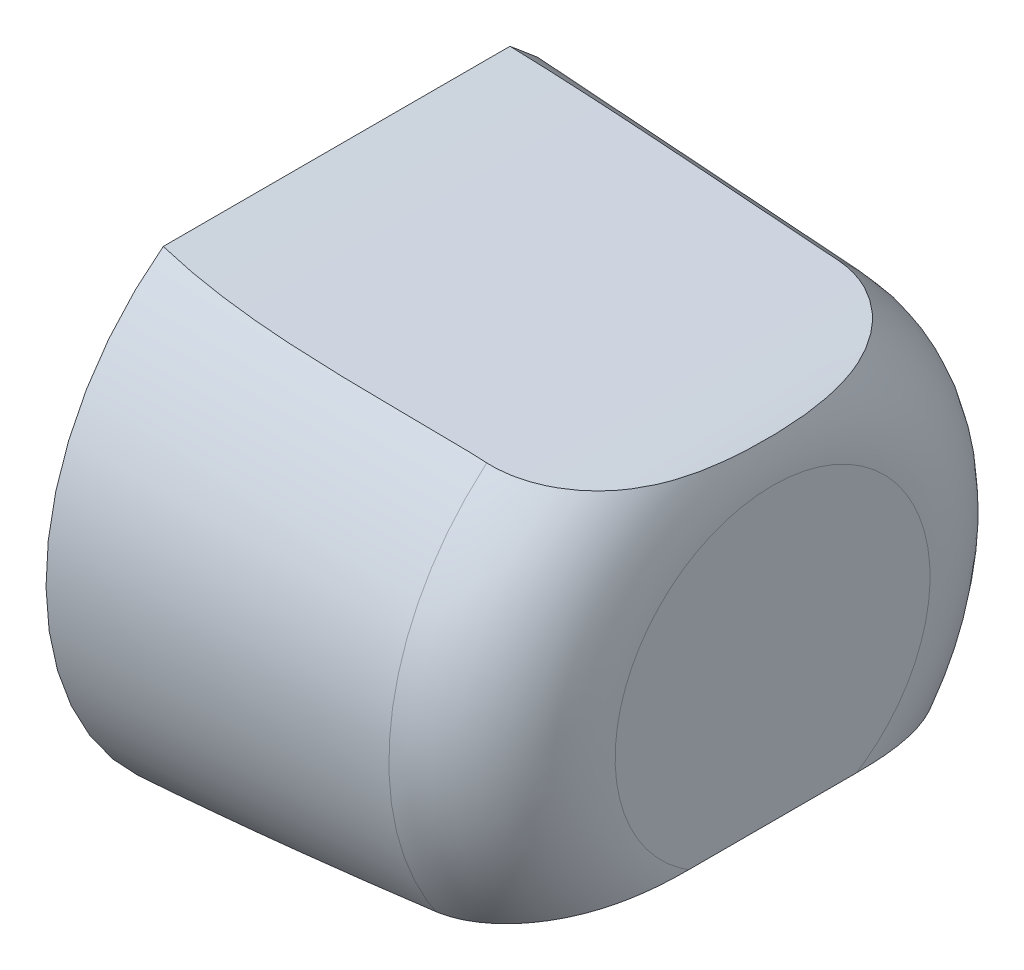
SolidWorks part; units mm, degrees
ref_plane "Plan de face" through (0, 0, 0) normal (0, 0, 1) x (1, 0, 0)
ref_plane "Plan de dessus" through (0, 0, 0) normal (0, 1, 0) x (1, 0, 0)
ref_plane "Plan de droite" through (0, 0, 0) normal (1, 0, 0) x (0, 0, -1)
sketch "Esquisse1" plane through (0, 0, 0) normal (1, 0, 0) x (0, 0, -1)
  circle A0 centre (0, 0) radius 10
  dimension "D1" = 20
extrude "Boss.-Extru.1" add sketch "Esquisse1" against normal blind 26
sketch "Esquisse3" plane through (0, 0, 0) normal (0, 1, 0) x (1, 0, 0)
  line L0 (-26, 0) -> (-26, -6)
  line L2 (0, 0) -> (-26, 0) construction
  line L7 (-26, 10) -> (-26, -10) construction
  line L8 (-26, -10) -> (0, -10) construction
  line L9 (-26, -10) -> (-10, -10)
  line L10 (-26, -10) -> (-26, -6)
  line L11 (-26, 6) -> (-10, 6)
  line L12 (-10, -10) -> (-10, -6)
  line L13 (-10, 10) -> (-10, 6)
  line L14 (-26, -6) -> (-10, -6)
  line L15 (-26, 10) -> (-26, 6)
  line L16 (-26, 10) -> (-10, 10)
  dimension "D4" = 16
  dimension "D5" = 12
extrude "Enlèv. mat.-Extru.1" cut sketch "Esquisse3" against normal through all and the other way through all contours L10 L9 L12 L14 | L15 L11 L13 L16
sketch "Esquisse4" plane through (0, 0, 0) normal (0, 0, 1) x (1, 0, 0)
  line L0 (0, 0) -> (-26, 0) construction
  line L1 (-26, 8) -> (-26, -8) construction
  circle A0 centre (-18.5, 0) radius 1.25
  dimension "D1" = 2.5
  dimension "D2" = 7.5
extrude "Enlèv. mat.-Extru.2" cut sketch "Esquisse4" against normal through all and the other way through all
sketch "Esquisse5" plane through (0, 0, 0) normal (0, 0, 1) x (1, 0, 0)
  line L0 (-25.7147, 6.7385) -> (-25.0489, -0.8716)
  line L1 (-26, -10) -> (0, -10) construction
  line L2 (-15.0869, -10) -> (0, -10)
  line L3 (0, -10) -> (0, 10)
  line L4 (0, 10) -> (-22.7261, 10)
  line L5 (-26, 8) -> (-26, -8) construction
  arc A0 (-15.0869, -10) -> (-25.0489, -0.8716) centre (-15.0869, 0) cw
  arc A1 (-22.7261, 10) -> (-25.7147, 6.7385) centre (-22.7261, 7) ccw
  point P13 (-24.2502, -10)
  point P16 (-26, 10)
  dimension "D2" = 10
  dimension "D3" = 3
  dimension "D1" = 5
extrude "Enlèv. mat.-Extru.3" cut sketch "Esquisse5" against normal through all and the other way through all flip side to cut
sketch "Esquisse6" plane through (0, 0, 0) normal (1, 0, 0) x (0, 0, -1)
  circle A0 centre (0, 0) radius 10
  circle A1 centre (0, 0) radius 10 construction
extrude "Boss.-Extru.2" add sketch "Esquisse6" along normal blind 15 draft 3
sketch "Esquisse7" plane through (0, 0, 0) normal (0, 0, 1) x (1, 0, 0)
  line L0 (0, 10) -> (-17.5013, 10) construction
  line L1 (15, -9.2139) -> (15, 9.2139) construction
  line L2 (15, -4.5865) -> (-14.9606, -10)
  line L3 (-15.0535, -10) -> (0, -10) construction
  line L4 (-14.9606, -10) -> (-14.9606, -14.4411)
  line L5 (-14.9606, -14.4411) -> (23.4972, -14.4411)
  line L6 (23.4972, -14.4411) -> (23.4972, 12.5649)
  line L7 (23.4972, 12.5649) -> (-6.9249, 12.5649)
  line L8 (-6.9249, 12.5649) -> (-6.9249, 10)
  spline S0 degree 3 poles (-6.9249, 10) (-1.613, 7.673) (8.9211, 7.4186) (21.794, 6.6986) (15, -4.5865) knots 0 0 0 0 0.499244 1 1 1 1
extrude "Enlèv. mat.-Extru.4" cut sketch "Esquisse7" against normal through all both and the other way through all
fillet "Congé1" radius 4 2 edges at (15, 1.2954, 9.1224) (15, 1.2954, -9.1224)
sketch "ZONE FSR" plane through (1.2768, -7.0661, 0) normal (0.1778, -0.9841, 0) x (0.9841, 0.1778, 0)
  line L0 (0, 0) -> (19.3909, 0) construction
  circle A0 centre (6.731, 0) radius 7.5 construction
  dimension "D1" = 15
sketch "Esquisse10" plane through (-24.9011, -2.1786, 0) normal (-0.9962, -0.0872, 0) x (0, 0, 1)
  line L1 (-3, 8.9541) -> (3, 8.9541)
  line L2 (-3, 8.9541) -> (-3, -5.0459)
  line L3 (-3, -5.0459) -> (3, -5.0459)
  line L4 (3, 8.9541) -> (3, -5.0459)
  line L5 (-6, 3.2202) -> (-6, 1.312) construction
  line L6 (6, 3.2202) -> (6, 1.312) construction
  point P10 (0, 8.9541)
  dimension "D1" = 3
  dimension "D2" = 3
  dimension "D3" = 14
extrude "Enlèv. mat.-Extru.6" cut sketch "Esquisse10" against normal blind 12
shell "Coque2" thickness 3
sketch "Sketch1" plane through (0, 0, 0) normal (1, 0, 0) x (0, 0, -1)
  line L1 (13.6817, 11.7954) -> (-13.0375, 11.7954)
  line L2 (13.6817, 11.7954) -> (13.6817, -11.2368)
  line L3 (13.6817, -11.2368) -> (-13.0375, -11.2368)
  line L4 (-13.0375, 11.7954) -> (-13.0375, -11.2368)
extrude "Cut-Extrude1" cut sketch "Sketch1" against normal through all
